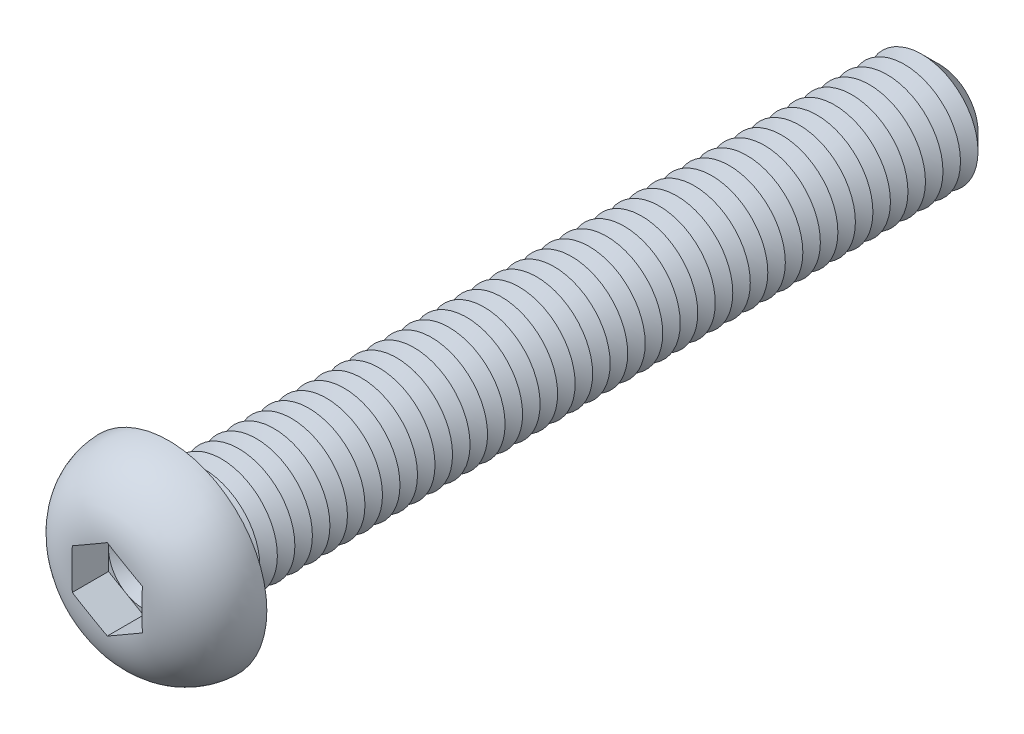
SolidWorks part; units mm, degrees
ref_plane "Front Plane" through (0, 0, 0) normal (0, 0, 1) x (1, 0, 0)
ref_plane "Top Plane" through (0, 0, 0) normal (0, 1, 0) x (1, 0, 0)
ref_plane "Right Plane" through (0, 0, 0) normal (1, 0, 0) x (0, 0, -1)
sketch "Sketch1" plane through (0, 0, 0) normal (1, 0, 0) x (0, 0, -1)
  line L0 (-47.9342, 0) -> (60.3146, 0) construction
sketch "Sketch2" plane through (0, 0, 0) normal (1, 0, 0) x (0, 0, -1)
  line L0 (0, 0) -> (-4.4, 0)
  line L1 (-47.9342, 0) -> (60.3146, 0) construction
  line L2 (-4.4, 0) -> (-4.4, 2.5011)
  line L3 (0, 7) -> (0, 0)
  arc A0 (-4.4, 2.5011) -> (0, 7) centre (0.1, 2.5011) cw
  dimension "D1" = 4.5
  dimension "D2" = 4.4
  dimension "D3" = 7
revolve "Revolve1" add sketch "Sketch2" angle 360 about L0
sketch "Sketch3" plane through (0, 0, 4.4) normal (0, 0, 1) x (1, 0, 0)
  line L1 (0, 2.8868) -> (-2.5, 1.4434)
  line L2 (-2.5, 1.4434) -> (-2.5, -1.4434)
  line L3 (-2.5, -1.4434) -> (0, -2.8868)
  line L4 (0, -2.8868) -> (2.5, -1.4434)
  line L5 (2.5, -1.4434) -> (2.5, 1.4434)
  line L6 (2.5, 1.4434) -> (0, 2.8868)
  circle A0 centre (0, 0) radius 2.5 construction
  dimension "D1" = 5
extrude "Cut-Extrude1" cut sketch "Sketch3" against normal blind 2.6
sketch "Sketch4" plane through (0, 0, 0) normal (0, 0, -1) x (-1, 0, 0)
  circle A0 centre (0, 0) radius 4
  dimension "D1" = 8
extrude "Boss-Extrude1" add sketch "Sketch4" along normal blind 55
chamfer "Chamfer1" distance 1.25 angle 45 1 edges at (-4, 0, -55)
sketch "Sketch5" plane through (0, 0, 0) normal (1, 0, 0) x (0, 0, -1)
  line L0 (1.25, 4) -> (2.5, 4)
  line L1 (53.75, 4) -> (0, 4) construction
  line L2 (2.5, 4) -> (1.875, 2.9175)
  line L3 (1.875, 2.9175) -> (1.25, 4)
  line L4 (0, -7) -> (0, 7) construction
  line L5 (53.75, 4) -> (0, 4) construction
  dimension "D1" = 1.25
  dimension "D2" = 1.25
revolve "Cut-Revolve1" cut sketch "Sketch5" angle 360 about L0
pattern_linear "LPattern1" count 42 spacing 1.25 along (0, 0, -1) of "Cut-Revolve1"
fillet "Fillet2" radius 0.5 1 edges at (4, 0, 0)
sketch "Sketch6" plane through (0, 0, 1.8) normal (0, 0, 1) x (1, 0, 0)
  line L0 (0, -2.8868) -> (2.5, -1.4434) construction
  circle A0 centre (0, 0) radius 2.5
extrude "Cut-Extrude2" cut sketch "Sketch6" against normal through all draft 60
